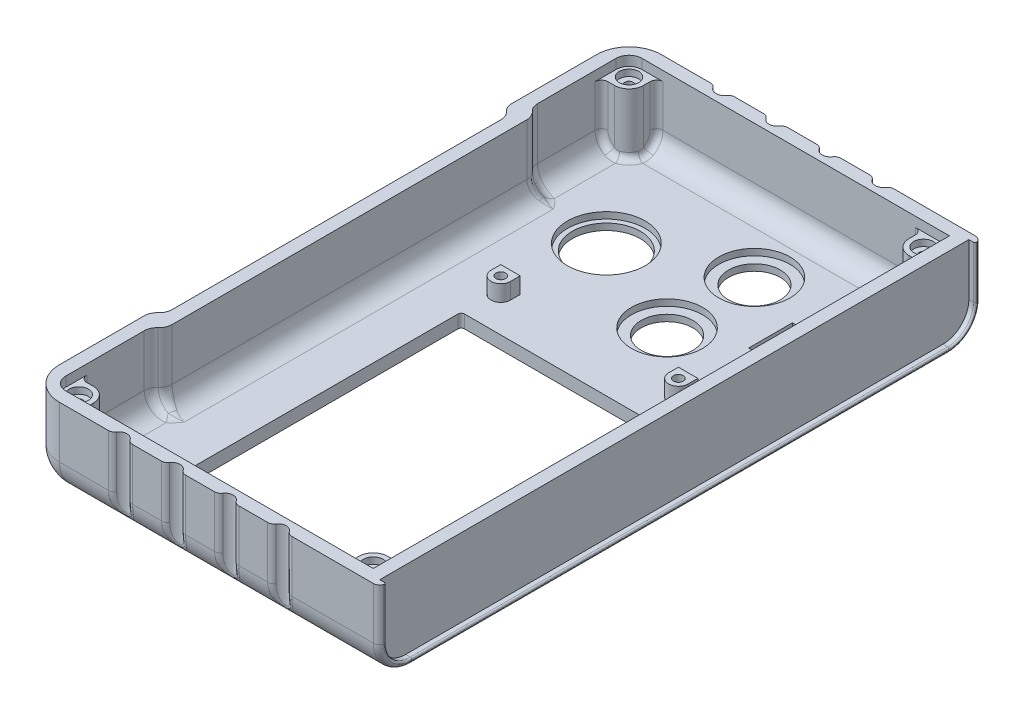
SolidWorks part; units mm, degrees
ref_plane "Front Plane" through (0, 0, 0) normal (0, 0, 1) x (1, 0, 0)
ref_plane "Top Plane" through (0, 0, 0) normal (0, 1, 0) x (1, 0, 0)
ref_plane "Right Plane" through (0, 0, 0) normal (1, 0, 0) x (0, 0, -1)
sketch "Sketch1" plane through (0, 0, 0) normal (0, 1, 0) x (1, 0, 0)
  line L0 (-53.5, 93) -> (-53.5, 53)
  line L1 (-53.5, 93) -> (53.5, 93)
  line L3 (-53.5, -93) -> (53.5, -93)
  line L4 (53.5, 93) -> (53.5, -93)
  line L5 (-53.5, 93) -> (53.5, -93) construction
  line L6 (-53.5, -93) -> (53.5, 93) construction
  line L7 (-53.5, 53) -> (-50.85, 53)
  line L8 (-50.85, 53) -> (-50.85, -53)
  line L9 (-50.85, -53) -> (-53.5, -53)
  line L10 (-53.5, -53) -> (-53.5, -93)
  point P0 (0, 0)
extrude "Boss-Extrude1" add sketch "Sketch1" along normal blind 4
sketch "Sketch2" plane through (0, 4, 0) normal (0, 1, 0) x (1, 0, 0)
  line L0 (-53.5, 93) -> (-53.5, 53)
  line L1 (-53.5, 93) -> (53.5, 93)
  line L3 (-53.5, -93) -> (53.5, -93)
  line L4 (53.5, 93) -> (53.5, -93)
  line L5 (-53.5, 93) -> (53.5, -93) construction
  line L6 (-53.5, -93) -> (53.5, 93) construction
  line L7 (-53.5, 53) -> (-50.85, 53)
  line L8 (-50.85, 53) -> (-50.85, -53)
  line L9 (-53.5, -93) -> (-53.5, -53)
  line L10 (-53.5, -53) -> (-53.5, -93) construction
  line L11 (-53.5, -53) -> (-50.85, -53)
  line L12 (-49.5, 89) -> (49.5, 89)
  line L13 (49.5, 89) -> (49.5, -89)
  line L14 (-49.5, -89) -> (49.5, -89)
  line L15 (-49.5, -89) -> (-49.5, -57)
  line L16 (-49.5, -57) -> (-46.85, -57)
  line L17 (-46.85, 57) -> (-46.85, -57)
  line L18 (-49.5, 57) -> (-46.85, 57)
  line L19 (-49.5, 89) -> (-49.5, 57)
  point P0 (0, 0)
extrude "Boss-Extrude2" add sketch "Sketch2" along normal blind 22
sketch "Sketch3" plane through (0, 4, 0) normal (0, 1, 0) x (1, 0, 0)
  line L0 (-49.5, 89) -> (-49.5, 57) construction
  line L3 (49.5, 89) -> (-49.5, 89) construction
  line L4 (49.5, -89) -> (49.5, 89) construction
  line L5 (49.5, 89) -> (-49.5, 89) construction
  line L6 (-49.5, -89) -> (49.5, -89) construction
  line L7 (-49.5, -57) -> (-49.5, -89) construction
  circle A0 centre (-45.5, 85) radius 3.5
  circle A1 centre (45.5, 85) radius 3.5
  circle A2 centre (45.5, -85) radius 3.5
  circle A3 centre (-45.5, -85) radius 3.5
  dimension "D1" = 7
  dimension "D2" = 4
  dimension "D3" = 4
  dimension "D4" = 4
  dimension "D5" = 4
  dimension "D6" = 4
  dimension "D7" = 4
  dimension "D8" = 4
  dimension "D9" = 4
extrude "Boss-Extrude3" add sketch "Sketch3" along normal blind 19
sketch "Sketch4" plane through (0, 4, 0) normal (0, 1, 0) x (1, 0, 0)
  line L0 (-49.5, 89) -> (-42, 89)
  line L1 (49.5, 89) -> (-49.5, 89) construction
  line L2 (-42, 89) -> (-42, 85)
  line L3 (-42, 85) -> (-45.5, 81.5)
  line L4 (-45.5, 81.5) -> (-49.5, 81.5)
  line L5 (-49.5, 89) -> (-49.5, 57) construction
  line L6 (-49.5, 81.5) -> (-49.5, 89)
  line L7 (42, 89) -> (49.5, 89)
  line L8 (49.5, 89) -> (-49.5, 89) construction
  line L9 (49.5, 89) -> (49.5, 81.5)
  line L10 (49.5, -89) -> (49.5, 89) construction
  line L11 (49.5, 81.5) -> (45.5, 81.5)
  line L12 (45.5, 81.5) -> (42, 85)
  line L13 (42, 85) -> (42, 89)
  line L14 (42, -89) -> (49.5, -89)
  line L15 (-49.5, -89) -> (49.5, -89) construction
  line L16 (49.5, -89) -> (49.5, -81.5)
  line L17 (49.5, -81.5) -> (45.5, -81.5)
  line L18 (45.5, -81.5) -> (42, -85)
  line L19 (42, -85) -> (42, -89)
  line L20 (-49.5, -81.5) -> (-45.5, -81.5)
  line L21 (-49.5, -57) -> (-49.5, -89) construction
  line L22 (-45.5, -81.5) -> (-42, -85)
  line L23 (-42, -85) -> (-42, -89)
  line L24 (-49.5, -89) -> (49.5, -89) construction
  line L25 (-42, -89) -> (-49.5, -89)
  line L26 (-49.5, -89) -> (-49.5, -81.5)
extrude "Boss-Extrude4" add sketch "Sketch4" along normal blind 19
sketch "Sketch5" plane through (0, 23, 0) normal (0, 1, 0) x (1, 0, 0)
  circle A0 centre (-45.5, 85) radius 3
  circle A1 centre (45.5, 85) radius 3
  circle A2 centre (45.5, -85) radius 3
  circle A3 centre (-45.5, -85) radius 3
  dimension "D1" = 6
extrude "Cut-Extrude1" cut sketch "Sketch5" against normal blind 2
sketch "Sketch6" plane through (0, 21, 0) normal (0, 1, 0) x (1, 0, 0)
  circle A0 centre (-45.5, 85) radius 1.25
  circle A1 centre (45.5, 85) radius 1.25
  circle A2 centre (45.5, -85) radius 1.25
  circle A3 centre (-45.5, -85) radius 1.25
  dimension "D1" = 2.5
extrude "Cut-Extrude2" cut sketch "Sketch6" against normal blind 9
sketch "Sketch7" plane through (0, 4, 0) normal (0, 1, 0) x (1, 0, 0)
  line L0 (-45.5, 81.5) -> (-49.5, 81.5)
  line L1 (-49.5, 81.5) -> (-49.5, 89)
  line L2 (49.5, 89) -> (-49.5, 89) construction
  line L3 (-42, 89) -> (-49.5, 89) construction
  line L4 (-49.5, 89) -> (-42, 89)
  line L5 (-42, 89) -> (-42, 85)
  line L6 (42, 89) -> (49.5, 89)
  line L7 (49.5, 89) -> (49.5, 81.5)
  line L8 (49.5, 81.5) -> (45.5, 81.5)
  line L9 (42, 89) -> (42, 85)
  line L10 (42, -89) -> (42, -85)
  line L11 (42, -89) -> (49.5, -89)
  line L12 (49.5, -89) -> (49.5, -81.5)
  line L13 (49.5, -81.5) -> (45.5, -81.5)
  line L14 (-42, -89) -> (-49.5, -89)
  line L15 (-49.5, -89) -> (-49.5, -81.5)
  line L16 (-49.5, -81.5) -> (-45.5, -81.5)
  line L17 (-42, -85) -> (-42, -89)
  line L18 (50.5, 80.5) -> (45.5, 80.5)
  line L19 (41, 90) -> (41, 85)
  line L20 (41, 90) -> (50.5, 90)
  line L21 (50.5, 90) -> (50.5, 80.5)
  line L22 (-45.5, 80.5) -> (-50.5, 80.5)
  line L23 (-50.5, 80.5) -> (-50.5, 90)
  line L24 (-50.5, 90) -> (-41, 90)
  line L25 (-41, 90) -> (-41, 85)
  line L26 (-41, -90) -> (-50.5, -90)
  line L27 (-50.5, -90) -> (-50.5, -80.5)
  line L28 (-50.5, -80.5) -> (-45.5, -80.5)
  line L29 (-41, -85) -> (-41, -90)
  line L30 (41, -90) -> (50.5, -90)
  line L31 (50.5, -90) -> (50.5, -80.5)
  line L32 (50.5, -80.5) -> (45.5, -80.5)
  line L33 (41, -90) -> (41, -85)
  arc A0 (-42, 85) -> (-45.5, 81.5) centre (-45.5, 85) cw
  arc A2 (45.5, 81.5) -> (42, 85) centre (45.5, 85) cw
  arc A3 (45.5, -81.5) -> (42, -85) centre (45.5, -85) ccw
  arc A4 (-45.5, -81.5) -> (-42, -85) centre (-45.5, -85) cw
  arc A5 (45.5, 80.5) -> (41, 85) centre (45.5, 85) cw
  arc A6 (-41, 85) -> (-45.5, 80.5) centre (-45.5, 85) cw
  arc A7 (-45.5, -80.5) -> (-41, -85) centre (-45.5, -85) cw
  arc A8 (45.5, -80.5) -> (41, -85) centre (45.5, -85) ccw
  dimension "D1" = 1
extrude "Boss-Extrude5" add sketch "Sketch7" along normal blind 19
fillet "Fillet1" radius 6 3 edges at (0, 4, 89) (-49.5, 4, -68.75) (0, 4, -89)
fillet "Fillet2" radius 2 26 edges at (-41, 16.5, -89) (-41.0747, 4.1179, -84.1837) (-41, 6.5359, -87.899) (-42.318, 4, -81.818) (-44.2923, 4.0525, -80.6651) (-48.399, 6.5359, -80.5) (-49.5, 16.5, -80.5) (-49.5, 16.5, 80.5) (-42.318, 4, 81.818) (-41.1651, 4.0525, 83.7923) (-41, 6.5359, 87.899) (-41, 16.5, 89) (41, 16.5, 89) (41, 6.5359, 87.899) (41.0747, 4.1179, 84.1837) (43.1283, 4, 81.1757) (47.5, 4, 80.5) (49.5, 13.5, 80.5) (49.5, 13.5, -80.5) (47.5, 4, -80.5) (43.1283, 4, -81.1757) (41.1651, 4.0525, -83.7923) (41, 6.5359, -87.899) (41, 16.5, -89) (-48.399, 6.5359, 80.5) (-44.6837, 4.1179, 80.5747)
sketch "Sketch8" plane through (0, 4, 0) normal (0, 1, 0) x (1, 0, 0)
  line L1 (-29.115, -79) -> (31.765, -79) construction
  line L2 (-29.115, -79) -> (-29.115, 29) construction
  line L3 (-29.115, 29) -> (31.765, 29) construction
  line L4 (31.765, -79) -> (31.765, 29) construction
  line L5 (-29.115, -79) -> (31.765, 29) construction
  line L6 (-29.115, 29) -> (31.765, -79) construction
  line L7 (-53.5, -93) -> (53.5, -93) construction
  line L9 (-50.85, 53) -> (-50.85, -53) construction
  line L10 (-27.515, 15.18) -> (30.165, 15.18)
  line L11 (-27.515, 15.18) -> (-27.515, -70.64)
  line L12 (-27.515, -70.64) -> (30.165, -70.64)
  line L13 (30.165, 15.18) -> (30.165, -70.64)
  point P0 (1.325, -25)
extrude "Cut-Extrude3" cut sketch "Sketch8" against normal blind 4
sketch "Sketch9" plane through (0, 4, 0) normal (0, 1, 0) x (1, 0, 0)
  line L0 (-50.85, 53) -> (-50.85, -53) construction
  line L1 (-29.115, -79) -> (31.765, -79) construction
  line L2 (-29.115, -79) -> (-29.115, 29) construction
  line L3 (-29.115, 29) -> (31.765, 29) construction
  line L4 (31.765, -79) -> (31.765, 29) construction
  line L5 (-29.115, -79) -> (31.765, 29) construction
  line L6 (-29.115, 29) -> (31.765, -79) construction
  line L7 (31.765, 26) -> (31.765, 29)
  line L8 (31.765, 29) -> (25.765, 29)
  line L9 (-53.5, -93) -> (53.5, -93) construction
  line L10 (-27.515, 15.18) -> (30.165, 15.18) construction
  line L11 (-27.515, 15.18) -> (-27.515, -70.64) construction
  line L12 (-27.515, -70.64) -> (30.165, -70.64) construction
  line L13 (30.165, 15.18) -> (30.165, -70.64) construction
  line L14 (25.765, 29) -> (25.765, 26)
  line L15 (-23.115, 26) -> (-23.115, 29)
  line L16 (-23.115, 29) -> (-29.115, 29)
  line L17 (-29.115, 29) -> (-29.115, 26)
  line L18 (-29.115, -76) -> (-29.115, -79)
  line L19 (-29.115, -79) -> (-23.115, -79)
  line L20 (-23.115, -79) -> (-23.115, -76)
  line L21 (25.765, -76) -> (25.765, -79)
  line L22 (25.765, -79) -> (31.765, -79)
  line L23 (31.765, -79) -> (31.765, -76)
  circle A0 centre (-26.115, -76) radius 3 construction
  circle A1 centre (28.765, -76) radius 3 construction
  circle A2 centre (28.765, 26) radius 3 construction
  circle A3 centre (-26.115, 26) radius 3 construction
  arc A4 (25.765, 26) -> (31.765, 26) centre (28.765, 26) ccw
  arc A5 (-29.115, 26) -> (-23.115, 26) centre (-26.115, 26) ccw
  arc A6 (-29.115, -76) -> (-23.115, -76) centre (-26.115, -76) cw
  arc A7 (25.765, -76) -> (31.765, -76) centre (28.765, -76) cw
  point P0 (1.325, -25)
extrude "Boss-Extrude6" add sketch "Sketch9" along normal blind 5
sketch "Sketch10" plane through (0, 9, 0) normal (0, 1, 0) x (1, 0, 0)
  circle A0 centre (-26.115, 26) radius 1.5
  circle A1 centre (28.765, 26) radius 1.5
  circle A2 centre (28.765, -76) radius 1.5
  circle A3 centre (-26.115, -76) radius 1.5
  dimension "D1" = 3
extrude "Cut-Extrude4" cut sketch "Sketch10" against normal blind 7
sketch "Sketch11" plane through (0, 4, 0) normal (0, 1, 0) x (1, 0, 0)
  line L0 (49.5, -78.5) -> (49.5, 78.5) construction
  line L2 (26.5, 63.5) -> (40, 63.5)
  line L3 (26.5, 63.5) -> (26.5, 50)
  line L4 (26.5, 50) -> (40, 50)
  line L5 (40, 63.5) -> (40, 50)
  line L9 (39.3153, 83) -> (-39.3153, 83) construction
extrude "Cut-Extrude5" cut sketch "Sketch11" against normal blind 2
sketch "Sketch12" plane through (0, 2, 0) normal (0, 1, 0) x (1, 0, 0)
  line L1 (39.3153, 83) -> (-39.3153, 83) construction
  line L2 (49.5, -78.5) -> (49.5, 78.5) construction
  circle A0 centre (33.25, 56.75) radius 3.5
extrude "Cut-Extrude6" cut sketch "Sketch12" against normal blind 2
sketch "Sketch13" plane through (0, 4, 0) normal (0, 1, 0) x (1, 0, 0)
  line L4 (49.5, -78.5) -> (49.5, 78.5) construction
  line L5 (39.3153, 83) -> (-39.3153, 83) construction
  circle A0 centre (8.5, 69.75) radius 9.25 construction
  circle A1 centre (8.5, 42.75) radius 9.25 construction
  circle A2 centre (-23.5, 56) radius 11.5 construction
  circle A4 centre (33.25, 56.75) radius 10.5 construction
  circle A5 centre (8.5, 69.75) radius 8
  circle A6 centre (8.5, 42.75) radius 8
  circle A7 centre (-23.5, 56) radius 10.5
extrude "Cut-Extrude7" cut sketch "Sketch13" against normal blind 4
fillet "Fillet3" radius 4 2 edges at (-53.5, 13, -53) (-53.5, 13, 53)
fillet "Fillet4" radius 4 2 edges at (-50.85, 13, -53) (-50.85, 13, 53)
fillet "Fillet5" radius 10 11 edges at (-53.5, 13, -93) (-53.5, 13, 93) (0, 0, -93) (-53.5, 0, -74.8827) (-53.1538, 0, -55.1374) (-51.1962, 0, -52.4453) (-50.85, 0, 0) (-51.1962, 0, 52.4453) (-53.1538, 0, 55.1374) (-53.5, 0, 74.8827) (0, 0, 93)
fillet "Fillet6" radius 6 1 edges at (-46.85, 5.0223, 0)
fillet "Fillet7" radius 4 2 edges at (-49.5, 24.5, 89) (-49.5, 24.5, -89)
sketch "Sketch14" plane through (0, 26, 0) normal (0, 1, 0) x (1, 0, 0)
  line L0 (53.5, 93) -> (-43.5, 93) construction
  line L1 (-43.5, -93) -> (53.5, -93) construction
  line L2 (-41, 86) -> (-41, 93) construction
  line L3 (-41, 85) -> (-41, 87) construction
  line L4 (-41, 93) -> (-24.6046, 93.5) construction
  line L5 (-24.6046, 93.5) -> (-8.2015, 93.5) construction
  line L6 (-8.2015, 93.5) -> (8.2015, 93.5) construction
  line L7 (8.2015, 93.5) -> (24.6046, 93.5) construction
  line L8 (24.6046, 93.5) -> (41, 93) construction
  line L9 (41, 93) -> (41, 86.4396) construction
  line L10 (41, 87) -> (41, 85) construction
  line L11 (41, 87) -> (41, 85) construction
  line L12 (24.6046, -93.5) -> (41, -93) construction
  line L13 (24.6046, -93.5) -> (8.2015, -93.5) construction
  line L14 (8.2015, -93.5) -> (-8.2015, -93.5) construction
  line L15 (-8.2015, -93.5) -> (-24.6046, -93.5) construction
  line L16 (-24.6046, -93.5) -> (-41, -93) construction
  line L17 (41, -85) -> (41, -87) construction
  line L18 (-41, -87) -> (-41, -85) construction
  line L19 (27.0541, 93) -> (22.1551, 93)
  line L20 (10.651, 93) -> (5.752, 93)
  line L21 (-5.752, 93) -> (-10.651, 93)
  line L22 (-22.1551, 93) -> (-27.0541, 93)
  line L23 (27.0541, -93) -> (22.1551, -93)
  line L24 (10.651, -93) -> (5.752, -93)
  line L25 (-5.752, -93) -> (-10.651, -93)
  line L26 (-22.1551, -93) -> (-27.0541, -93)
  arc A0 (-22.1551, 93) -> (-27.0541, 93) centre (-24.6046, 93.5) cw
  arc A1 (-5.752, 93) -> (-10.651, 93) centre (-8.2015, 93.5) cw
  arc A2 (10.651, 93) -> (5.752, 93) centre (8.2015, 93.5) cw
  arc A3 (27.0541, 93) -> (22.1551, 93) centre (24.6046, 93.5) cw
  arc A4 (-27.0541, -93) -> (-22.1551, -93) centre (-24.6046, -93.5) cw
  arc A5 (-10.651, -93) -> (-5.752, -93) centre (-8.2015, -93.5) cw
  arc A6 (5.752, -93) -> (10.651, -93) centre (8.2015, -93.5) cw
  arc A7 (22.1551, -93) -> (27.0541, -93) centre (24.6046, -93.5) cw
  dimension "D5" = 2.5
  dimension "D6" = 2.5
  dimension "D7" = 2.5
  dimension "D8" = 2.5
  dimension "D13" = 2.5
  dimension "D14" = 2.5
  dimension "D15" = 2.5
  dimension "D16" = 2.5
  dimension "D1" = 0.5
  dimension "D2" = 0.5
  dimension "D3" = 0.5
  dimension "D4" = 0.5
  dimension "D9" = 0.5
  dimension "D10" = 0.5
  dimension "D11" = 0.5
  dimension "D12" = 0.5
  dimension "D17" = 0
  dimension "D18" = 0
  dimension "D19" = 0
extrude "Cut-Extrude8" cut sketch "Sketch14" against normal blind 91
fillet "Fillet8" radius 2 24 edges at (-24.8687, 4.0187, -91.014) (-8.4656, 4.0187, -91.014) (7.9374, 4.0187, -91.014) (24.3405, 4.0187, -91.014) (24.8687, 4.0187, 91.014) (8.4656, 4.0187, 91.014) (-7.9374, 4.0187, 91.014) (-24.3405, 4.0187, 91.014) (-27.0541, 18, 93) (-22.1551, 18, 93) (27.0541, 18, -93) (22.1551, 18, -93) (10.651, 18, -93) (5.752, 18, -93) (-5.752, 18, -93) (-10.651, 18, -93) (-10.651, 18, 93) (-5.752, 18, 93) (5.752, 18, 93) (10.651, 18, 93) (22.1551, 18, 93) (27.0541, 18, 93) (-22.1551, 18, -93) (-27.0541, 18, -93)
fillet "Fillet9" radius 4 6 edges at (-42.175, 4, -57) (-47.7426, 5.7574, -57) (-42.175, 4, 57) (-47.7426, 5.7574, 57) (-49.5, 18, -57) (-49.5, 18, 57)
fillet "Fillet10" radius 4 6 edges at (-43.5252, 4.6294, -57) (-46.5392, 8.0941, -57) (-43.5252, 4.6294, 57) (-46.5392, 8.0941, 57) (-46.85, 18, -57) (-46.85, 18, 57)
sketch "Sketch15" plane through (0, 4, 0) normal (0, 1, 0) x (1, 0, 0)
  line L0 (49.5, -78.5) -> (49.5, 78.5) construction
  line L1 (39.3153, 83) -> (-39.3153, 83) construction
  line L2 (49.5, -89) -> (49.5, 89) construction
  circle A0 centre (8.5, 69.75) radius 11
  circle A1 centre (8.5, 42.75) radius 11
  circle A2 centre (-23.5, 56) radius 12
  dimension "D7" = 22
  dimension "D8" = 22
  dimension "D9" = 24
  dimension "D1" = 41
  dimension "D2" = 41
  dimension "D3" = 13.25
  dimension "D4" = 40.25
  dimension "D5" = 73
  dimension "D6" = 27
extrude "Cut-Extrude9" cut sketch "Sketch15" against normal blind 2
sketch "Sketch16" plane through (53.5, 0, 0) normal (1, 0, 0) x (0, 0, -1)
  line L0 (-93, 26) -> (-93, 10)
  line L1 (-83, 0) -> (83, 0)
  line L2 (93, 26) -> (93, 10)
  line L3 (-91, 26) -> (-91, 10)
  line L4 (-83, 2) -> (83, 2)
  line L5 (91, 26) -> (91, 10)
  line L6 (-93, 26) -> (-91, 26)
  line L7 (91, 26) -> (93, 26)
  arc A0 (-93, 10) -> (-83, 0) centre (-83, 10) ccw
  arc A1 (93, 10) -> (83, 0) centre (83, 10) cw
  arc A2 (-91, 10) -> (-83, 2) centre (-83, 10) ccw
  arc A3 (91, 10) -> (83, 2) centre (83, 10) cw
  dimension "D1" = 2
extrude "Boss-Extrude7" add sketch "Sketch16" along normal blind 2
fillet "Fillet11" radius 2 5 edges at (55.5, 18, -93) (55.5, 2.9289, -90.0711) (55.5, 0, 0) (55.5, 2.9289, 90.0711) (55.5, 18, 93)
fillet "Fillet12" radius 0.5 5 edges at (55.5, 18, 91) (55.5, 4.3431, 88.6569) (55.5, 2, 0) (55.5, 4.3431, -88.6569) (55.5, 18, -91)
fillet "Fillet13" radius 1 4 edges at (-27.515, 2, 70.64) (-27.515, 2, -15.18) (30.165, 2, -15.18) (30.165, 2, 70.64)
equation "\"Total_Width\"= 120 - 6 - 7"
equation "\"D1@Sketch1\" = \"Total_Width\""
equation "\"Total_Length\"= 200 - 14"
equation "\"D2@Sketch1\" = \"Total_Length\""
equation "\"Cutout_Offset_Left\"= 40"
equation "\"Cutout_Depth\"= 2.65"
equation "\"D5@Sketch1\" = \"Cutout_Depth\""
equation "\"D3@Sketch1\" = \"Cutout_Offset_Left\""
equation "\"Cutout_Length\"= \"Total_Length\" - 2 * \"Cutout_Offset_Left\""
equation "\"D4@Sketch1\" = \"Cutout_Length\""
equation "\"D6@Sketch1\" = \"Total_Width\" / 2"
equation "\"D1@Sketch2\" = \"Total_Width\""
equation "\"D2@Sketch2\" = \"Total_Length\""
equation "\"D3@Sketch2\" = \"Cutout_Offset_Left\""
equation "\"D4@Sketch2\" = \"Cutout_Length\""
equation "\"D5@Sketch2\" = \"Cutout_Depth\""
equation "\"D6@Sketch2\" = \"Total_Width\" / 2"
equation "\"Upper_Part_Height\"= 22"
equation "\"D1@Boss-Extrude2\" = \"Upper_Part_Height\""
equation "\"Screw_Boss_Height\"= \"Upper_Part_Height\" - 3"
equation "\"D1@Boss-Extrude3\"=\"Screw_Boss_Height\""
equation "\"D1@Sketch4\"=7.50"
equation "\"D1@Boss-Extrude4\" = \"Screw_Boss_Height\""
equation "\"D1@Boss-Extrude5\"=\"Screw_Boss_Height\""
equation "\"D3@Sketch9\" =  ( \"Total_Width\" - \"Cutout_Depth\" )  / 2"
equation "\"D4@Sketch8\" =  ( \"Total_Width\" - \"Cutout_Depth\" )  / 2"
equation "\"Rotary_Y\"= 8.5"
equation "\"Rotary_X\"= 19.5"
equation "\"D4@Sketch11\"=\"Rotary_X\""
equation "\"D2@Sketch12\"=\"Rotary_X\"+6.75"
equation "\"Button_X\"= 19.5"
equation "\"Button_Y1\"= 39"
equation "\"Button_Y2\"= 73"
equation "\"D10@Sketch13\"=\"Button_Y2\""
